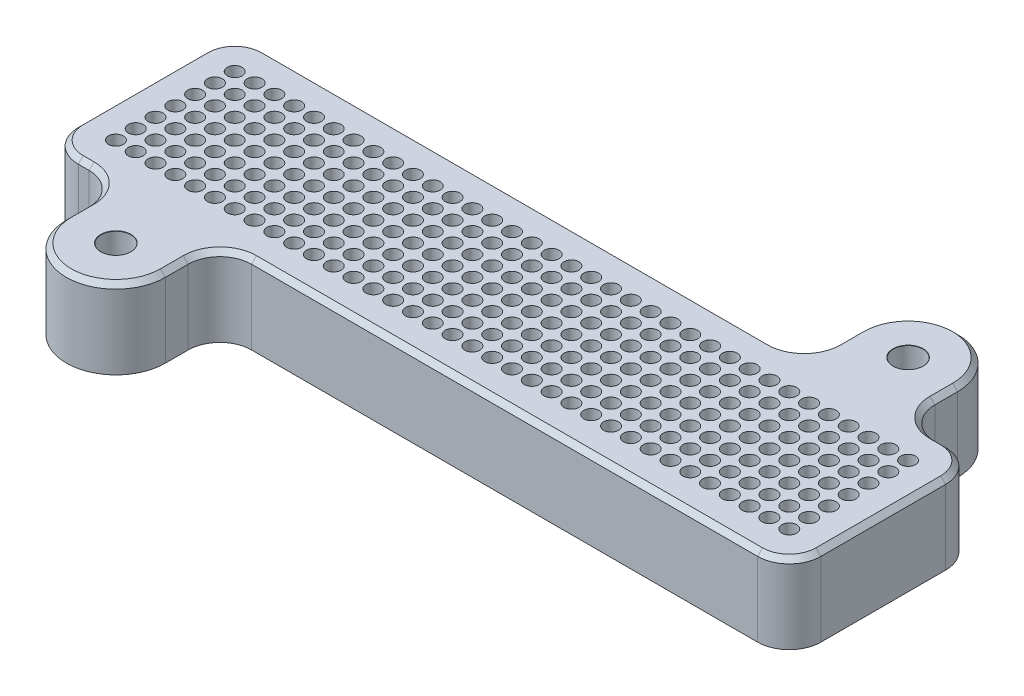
SolidWorks part; units mm, degrees
ref_plane "Front Plane" through (0, 0, 0) normal (0, 0, 1) x (1, 0, 0)
ref_plane "Top Plane" through (0, 0, 0) normal (0, 1, 0) x (1, 0, 0)
ref_plane "Right Plane" through (0, 0, 0) normal (1, 0, 0) x (0, 0, -1)
sketch "Sketch2" plane through (0, 0, 0) normal (0, 1, 0) x (1, 0, 0)
  line L0 (-37.5, 9.5) -> (20, 9.5)
  line L6 (-37.5, -9.5) -> (-37.5, 9.5)
  line L8 (37.5, -9.5) -> (37.5, 9.5)
  line L9 (-37.5, -9.5) -> (37.5, 9.5) construction
  line L10 (-37.5, 9.5) -> (37.5, -9.5) construction
  line L17 (-37.5, -9.5) -> (-30, -9.5)
  line L18 (-30, -15) -> (-30, -9.5)
  line L19 (20, 15) -> (20, 9.5)
  line L20 (-20, -15) -> (-20, -9.5)
  line L22 (30, 15) -> (30, 9.5)
  line L23 (-20, -9.5) -> (37.5, -9.5)
  line L24 (30, 9.5) -> (37.5, 9.5)
  circle A245 centre (0, 0) radius 0.75
  circle A246 centre (2, 0) radius 0.75
  circle A247 centre (4, 0) radius 0.75
  circle A248 centre (6, 0) radius 0.75
  circle A249 centre (8, 0) radius 0.75
  circle A250 centre (10, 0) radius 0.75
  circle A251 centre (12, 0) radius 0.75
  circle A252 centre (14, 0) radius 0.75
  circle A253 centre (16, 0) radius 0.75
  circle A254 centre (18, 0) radius 0.75
  circle A255 centre (20, 0) radius 0.75
  circle A256 centre (22, 0) radius 0.75
  circle A257 centre (24, 0) radius 0.75
  circle A258 centre (26, 0) radius 0.75
  circle A259 centre (28, 0) radius 0.75
  circle A260 centre (30, 0) radius 0.75
  circle A261 centre (32, 0) radius 0.75
  circle A262 centre (34, 0) radius 0.75
  circle A263 centre (2, 2) radius 0.75
  circle A264 centre (4, 2) radius 0.75
  circle A265 centre (6, 2) radius 0.75
  circle A266 centre (8, 2) radius 0.75
  circle A267 centre (10, 2) radius 0.75
  circle A268 centre (12, 2) radius 0.75
  circle A269 centre (14, 2) radius 0.75
  circle A270 centre (16, 2) radius 0.75
  circle A271 centre (18, 2) radius 0.75
  circle A272 centre (20, 2) radius 0.75
  circle A273 centre (22, 2) radius 0.75
  circle A274 centre (24, 2) radius 0.75
  circle A275 centre (26, 2) radius 0.75
  circle A276 centre (28, 2) radius 0.75
  circle A277 centre (30, 2) radius 0.75
  circle A278 centre (32, 2) radius 0.75
  circle A279 centre (34, 2) radius 0.75
  circle A280 centre (2, 4) radius 0.75
  circle A281 centre (4, 4) radius 0.75
  circle A282 centre (6, 4) radius 0.75
  circle A283 centre (8, 4) radius 0.75
  circle A284 centre (10, 4) radius 0.75
  circle A285 centre (12, 4) radius 0.75
  circle A286 centre (14, 4) radius 0.75
  circle A287 centre (16, 4) radius 0.75
  circle A288 centre (18, 4) radius 0.75
  circle A289 centre (20, 4) radius 0.75
  circle A290 centre (22, 4) radius 0.75
  circle A291 centre (24, 4) radius 0.75
  circle A292 centre (26, 4) radius 0.75
  circle A293 centre (28, 4) radius 0.75
  circle A294 centre (30, 4) radius 0.75
  circle A295 centre (32, 4) radius 0.75
  circle A296 centre (34, 4) radius 0.75
  circle A297 centre (2, 6) radius 0.75
  circle A298 centre (4, 6) radius 0.75
  circle A299 centre (6, 6) radius 0.75
  circle A300 centre (8, 6) radius 0.75
  circle A301 centre (10, 6) radius 0.75
  circle A302 centre (12, 6) radius 0.75
  circle A303 centre (14, 6) radius 0.75
  circle A304 centre (16, 6) radius 0.75
  circle A305 centre (18, 6) radius 0.75
  circle A306 centre (20, 6) radius 0.75
  circle A307 centre (22, 6) radius 0.75
  circle A308 centre (24, 6) radius 0.75
  circle A309 centre (26, 6) radius 0.75
  circle A310 centre (28, 6) radius 0.75
  circle A311 centre (30, 6) radius 0.75
  circle A312 centre (32, 6) radius 0.75
  circle A313 centre (34, 6) radius 0.75
  circle A314 centre (0, 2) radius 0.75
  circle A315 centre (0, 4) radius 0.75
  circle A316 centre (0, 6) radius 0.75
  circle A317 centre (-2, 0) radius 0.75
  circle A318 centre (-2, 2) radius 0.75
  circle A319 centre (-2, 4) radius 0.75
  circle A320 centre (-2, 6) radius 0.75
  circle A321 centre (-4, 0) radius 0.75
  circle A322 centre (-4, 2) radius 0.75
  circle A323 centre (-4, 4) radius 0.75
  circle A324 centre (-4, 6) radius 0.75
  circle A325 centre (-6, 0) radius 0.75
  circle A326 centre (-6, 2) radius 0.75
  circle A327 centre (-6, 4) radius 0.75
  circle A328 centre (-6, 6) radius 0.75
  circle A329 centre (-8, 0) radius 0.75
  circle A330 centre (-8, 2) radius 0.75
  circle A331 centre (-8, 4) radius 0.75
  circle A332 centre (-8, 6) radius 0.75
  circle A333 centre (-10, 0) radius 0.75
  circle A334 centre (-10, 2) radius 0.75
  circle A335 centre (-10, 4) radius 0.75
  circle A336 centre (-10, 6) radius 0.75
  circle A337 centre (-12, 0) radius 0.75
  circle A338 centre (-12, 2) radius 0.75
  circle A339 centre (-12, 4) radius 0.75
  circle A340 centre (-12, 6) radius 0.75
  circle A341 centre (-14, 0) radius 0.75
  circle A342 centre (-14, 2) radius 0.75
  circle A343 centre (-14, 4) radius 0.75
  circle A344 centre (-14, 6) radius 0.75
  circle A345 centre (-16, 0) radius 0.75
  circle A346 centre (-16, 2) radius 0.75
  circle A347 centre (-16, 4) radius 0.75
  circle A348 centre (-16, 6) radius 0.75
  circle A349 centre (-18, 0) radius 0.75
  circle A350 centre (-18, 2) radius 0.75
  circle A351 centre (-18, 4) radius 0.75
  circle A352 centre (-18, 6) radius 0.75
  circle A353 centre (-20, 0) radius 0.75
  circle A354 centre (-20, 2) radius 0.75
  circle A355 centre (-20, 4) radius 0.75
  circle A356 centre (-20, 6) radius 0.75
  circle A357 centre (-22, 0) radius 0.75
  circle A358 centre (-22, 2) radius 0.75
  circle A359 centre (-22, 4) radius 0.75
  circle A360 centre (-22, 6) radius 0.75
  circle A361 centre (-24, 0) radius 0.75
  circle A362 centre (-24, 2) radius 0.75
  circle A363 centre (-24, 4) radius 0.75
  circle A364 centre (-24, 6) radius 0.75
  circle A365 centre (-26, 0) radius 0.75
  circle A366 centre (-26, 2) radius 0.75
  circle A367 centre (-26, 4) radius 0.75
  circle A368 centre (-26, 6) radius 0.75
  circle A369 centre (-28, 0) radius 0.75
  circle A370 centre (-28, 2) radius 0.75
  circle A371 centre (-28, 4) radius 0.75
  circle A372 centre (-28, 6) radius 0.75
  circle A373 centre (-30, 0) radius 0.75
  circle A374 centre (-30, 2) radius 0.75
  circle A375 centre (-30, 4) radius 0.75
  circle A376 centre (-30, 6) radius 0.75
  circle A377 centre (-32, 0) radius 0.75
  circle A378 centre (-32, 2) radius 0.75
  circle A379 centre (-32, 4) radius 0.75
  circle A380 centre (-32, 6) radius 0.75
  circle A381 centre (-34, 0) radius 0.75
  circle A382 centre (-34, 2) radius 0.75
  circle A383 centre (-34, 4) radius 0.75
  circle A384 centre (-34, 6) radius 0.75
  circle A385 centre (0, -2) radius 0.75
  circle A386 centre (2, -2) radius 0.75
  circle A387 centre (4, -2) radius 0.75
  circle A388 centre (6, -2) radius 0.75
  circle A389 centre (8, -2) radius 0.75
  circle A390 centre (10, -2) radius 0.75
  circle A391 centre (12, -2) radius 0.75
  circle A392 centre (14, -2) radius 0.75
  circle A393 centre (16, -2) radius 0.75
  circle A394 centre (18, -2) radius 0.75
  circle A395 centre (20, -2) radius 0.75
  circle A396 centre (22, -2) radius 0.75
  circle A397 centre (24, -2) radius 0.75
  circle A398 centre (26, -2) radius 0.75
  circle A399 centre (28, -2) radius 0.75
  circle A400 centre (30, -2) radius 0.75
  circle A401 centre (32, -2) radius 0.75
  circle A402 centre (34, -2) radius 0.75
  circle A403 centre (-2, -2) radius 0.75
  circle A404 centre (-4, -2) radius 0.75
  circle A405 centre (-6, -2) radius 0.75
  circle A406 centre (-8, -2) radius 0.75
  circle A407 centre (-10, -2) radius 0.75
  circle A408 centre (-12, -2) radius 0.75
  circle A409 centre (-14, -2) radius 0.75
  circle A410 centre (-16, -2) radius 0.75
  circle A411 centre (-18, -2) radius 0.75
  circle A412 centre (-20, -2) radius 0.75
  circle A413 centre (-22, -2) radius 0.75
  circle A414 centre (-24, -2) radius 0.75
  circle A415 centre (-26, -2) radius 0.75
  circle A416 centre (-28, -2) radius 0.75
  circle A417 centre (-30, -2) radius 0.75
  circle A418 centre (-32, -2) radius 0.75
  circle A419 centre (-34, -2) radius 0.75
  circle A420 centre (0, -4) radius 0.75
  circle A421 centre (2, -4) radius 0.75
  circle A422 centre (4, -4) radius 0.75
  circle A423 centre (6, -4) radius 0.75
  circle A424 centre (8, -4) radius 0.75
  circle A425 centre (10, -4) radius 0.75
  circle A426 centre (12, -4) radius 0.75
  circle A427 centre (14, -4) radius 0.75
  circle A428 centre (16, -4) radius 0.75
  circle A429 centre (18, -4) radius 0.75
  circle A430 centre (20, -4) radius 0.75
  circle A431 centre (22, -4) radius 0.75
  circle A432 centre (24, -4) radius 0.75
  circle A433 centre (26, -4) radius 0.75
  circle A434 centre (28, -4) radius 0.75
  circle A435 centre (30, -4) radius 0.75
  circle A436 centre (32, -4) radius 0.75
  circle A437 centre (34, -4) radius 0.75
  circle A438 centre (-2, -4) radius 0.75
  circle A439 centre (-4, -4) radius 0.75
  circle A440 centre (-6, -4) radius 0.75
  circle A441 centre (-8, -4) radius 0.75
  circle A442 centre (-10, -4) radius 0.75
  circle A443 centre (-12, -4) radius 0.75
  circle A444 centre (-14, -4) radius 0.75
  circle A445 centre (-16, -4) radius 0.75
  circle A446 centre (-18, -4) radius 0.75
  circle A447 centre (-20, -4) radius 0.75
  circle A448 centre (-22, -4) radius 0.75
  circle A449 centre (-24, -4) radius 0.75
  circle A450 centre (-26, -4) radius 0.75
  circle A451 centre (-28, -4) radius 0.75
  circle A452 centre (-30, -4) radius 0.75
  circle A453 centre (-32, -4) radius 0.75
  circle A454 centre (-34, -4) radius 0.75
  circle A455 centre (0, -6) radius 0.75
  circle A456 centre (2, -6) radius 0.75
  circle A457 centre (4, -6) radius 0.75
  circle A458 centre (6, -6) radius 0.75
  circle A459 centre (8, -6) radius 0.75
  circle A460 centre (10, -6) radius 0.75
  circle A461 centre (12, -6) radius 0.75
  circle A462 centre (14, -6) radius 0.75
  circle A463 centre (16, -6) radius 0.75
  circle A464 centre (18, -6) radius 0.75
  circle A465 centre (20, -6) radius 0.75
  circle A466 centre (22, -6) radius 0.75
  circle A467 centre (24, -6) radius 0.75
  circle A468 centre (26, -6) radius 0.75
  circle A469 centre (28, -6) radius 0.75
  circle A470 centre (30, -6) radius 0.75
  circle A471 centre (32, -6) radius 0.75
  circle A472 centre (34, -6) radius 0.75
  circle A473 centre (-2, -6) radius 0.75
  circle A474 centre (-4, -6) radius 0.75
  circle A475 centre (-6, -6) radius 0.75
  circle A476 centre (-8, -6) radius 0.75
  circle A477 centre (-10, -6) radius 0.75
  circle A478 centre (-12, -6) radius 0.75
  circle A479 centre (-14, -6) radius 0.75
  circle A480 centre (-16, -6) radius 0.75
  circle A481 centre (-18, -6) radius 0.75
  circle A482 centre (-20, -6) radius 0.75
  circle A483 centre (-22, -6) radius 0.75
  circle A484 centre (-24, -6) radius 0.75
  circle A485 centre (-26, -6) radius 0.75
  circle A486 centre (-28, -6) radius 0.75
  circle A487 centre (-30, -6) radius 0.75
  circle A488 centre (-32, -6) radius 0.75
  circle A489 centre (-34, -6) radius 0.75
  arc A494 (-30, -15) -> (-20, -15) centre (-25, -15) ccw
  arc A495 (30, 15) -> (20, 15) centre (25, 15) ccw
  point P0 (0, 0)
  point P10 (-2, 0)
  point P161 (-4, 0)
  point P170 (-6, 0)
  point P179 (-8, 0)
  point P188 (-10, 0)
  point P197 (-12, 0)
  point P206 (-14, 0)
  point P215 (-16, 0)
  point P224 (-18, 0)
  point P233 (-20, 0)
  point P242 (-22, 0)
  point P251 (-24, 0)
  point P260 (-26, 0)
  point P269 (-28, 0)
  point P278 (-30, 0)
  point P287 (-32, 0)
  point P296 (-34, 0)
  point P305 (0, -2)
  point P308 (-2, -2)
  point P345 (-4, -2)
  point P348 (-6, -2)
  point P351 (-8, -2)
  point P354 (-10, -2)
  point P357 (-12, -2)
  point P360 (-14, -2)
  point P363 (-16, -2)
  point P366 (-18, -2)
  point P369 (-20, -2)
  point P372 (-22, -2)
  point P375 (-24, -2)
  point P378 (-26, -2)
  point P381 (-28, -2)
  point P384 (-30, -2)
  point P387 (-32, -2)
  point P390 (-34, -2)
  point P393 (0, -4)
  point P396 (-2, -4)
  point P433 (-4, -4)
  point P436 (-6, -4)
  point P439 (-8, -4)
  point P442 (-10, -4)
  point P445 (-12, -4)
  point P448 (-14, -4)
  point P451 (-16, -4)
  point P454 (-18, -4)
  point P457 (-20, -4)
  point P460 (-22, -4)
  point P463 (-24, -4)
  point P466 (-26, -4)
  point P469 (-28, -4)
  point P472 (-30, -4)
  point P475 (-32, -4)
  point P478 (-34, -4)
  point P481 (0, -6)
  point P484 (-2, -6)
  point P522 (-4, -6)
  point P525 (-6, -6)
  point P528 (-8, -6)
  point P531 (-10, -6)
  point P534 (-12, -6)
  point P537 (-14, -6)
  point P540 (-16, -6)
  point P543 (-18, -6)
  point P546 (-20, -6)
  point P549 (-22, -6)
  point P552 (-24, -6)
  point P555 (-26, -6)
  point P558 (-28, -6)
  point P561 (-30, -6)
  point P564 (-32, -6)
  point P567 (-34, -6)
  dimension "D2" = 19
  dimension "D6" = 18
extrude "Boss-Extrude1" add sketch "Sketch2" along normal blind 8
sketch "Sketch3" plane through (0, 0, 0) normal (0, -1, 0) x (1, 0, 0)
  line L21 (-35, -7) -> (35, -7)
  line L22 (-35, -7) -> (-35, 7)
  line L23 (-35, 7) -> (35, 7)
  line L24 (35, -7) -> (35, 7)
  line L25 (-35, -7) -> (35, 7) construction
  line L26 (-35, 7) -> (35, -7) construction
  line L36 (30, -9.5) -> (37.5, -9.5)
  line L37 (37.5, -9.5) -> (37.5, 9.5)
  line L38 (37.5, 9.5) -> (-20, 9.5)
  line L39 (-20, 9.5) -> (-20, 15)
  line L40 (-30, 15) -> (-30, 9.5)
  line L41 (-30, 9.5) -> (-37.5, 9.5)
  line L42 (-37.5, 9.5) -> (-37.5, -9.5)
  line L43 (-37.5, -9.5) -> (20, -9.5)
  line L44 (20, -9.5) -> (20, -15)
  line L45 (30, -15) -> (30, -9.5)
  line L46 (30, -9.5) -> (37.5, -9.5)
  line L47 (37.5, -9.5) -> (37.5, 9.5)
  line L48 (37.5, 9.5) -> (-20, 9.5)
  line L49 (-20, 9.5) -> (-20, 15)
  line L50 (-30, 15) -> (-30, 9.5)
  line L51 (-30, 9.5) -> (-37.5, 9.5)
  line L52 (-37.5, 9.5) -> (-37.5, -9.5)
  line L53 (-37.5, -9.5) -> (20, -9.5)
  line L54 (20, -9.5) -> (20, -15)
  line L55 (30, -15) -> (30, -9.5)
  arc A6 (-20, 15) -> (-30, 15) centre (-25, 15) ccw
  arc A7 (20, -15) -> (30, -15) centre (25, -15) ccw
  arc A8 (-20, 15) -> (-30, 15) centre (-25, 15) ccw
  arc A9 (20, -15) -> (30, -15) centre (25, -15) ccw
  point P3 (0, 0)
  dimension "D1" = 0
  dimension "D2" = 14
fillet "Fillet7" radius 3.2004 8 edges at (37.5, 4, 9.5) (-20, 4, 9.5) (-30, 4, 9.5) (-37.5, 4, 9.5) (-37.5, 4, -9.5) (20, 4, -9.5) (37.5, 4, -9.5) (30, 4, -9.5)
hole_wizard "Ø3.0mm Dowel Hole1" positions "Sketch4" profile "Sketch5" hole size "Ø3.0" standard "ANSI Metric"
sketch "Sketch4" plane through (0, 8, 0) normal (0, 1, 0) x (1, 0, 0)
  point P0 (-25, -15)
  point P3 (25, 15)
sketch "Sketch5" plane through (-25, 8, 15) normal (1, 0, 0) x (0, 0, 1)
  line L0 (0, 0) -> (0, 10.9013)
  line L1 (0, 10.9013) -> (1.5, 10)
  line L2 (1.5, 10) -> (1.5, 0.025)
  line L3 (1.5, 0.025) -> (1.525, 0)
  line L5 (1.525, 0) -> (0, 0)
  line L6 (-1.5, 0.025) -> (-1.525, 0) construction
  line L10 (0, 10.9013) -> (-1.5, 10) construction
  line L11 (0, -6.35) -> (0, 107.95) construction
  dimension "Hole Dia." = 3
  dimension "Hole Depth" = 10
  dimension "Near C'Sink Dia." = 3.05
  dimension "Near C'Sink Angle" = 90
  dimension "Drill Angle" = 118
chamfer "Chamfer1" distance 0.5 angle 45 20 edges at (-19.0626, 8, 10.4374) (-20, 8, 13.8502) (-25, 8, 20) (-30, 8, 13.8502) (-30.9374, 8, 10.4374) (-33.75, 8, 9.5) (-36.5626, 8, 8.5626) (-37.5, 8, 0) (-36.5626, 8, -8.5626) (-8.75, 8, -9.5) (19.0626, 8, -10.4374) (20, 8, -13.8502) (25, 8, -20) (30, 8, -13.8502) (30.9374, 8, -10.4374) (33.75, 8, -9.5) (36.5626, 8, -8.5626) (37.5, 8, 0) (36.5626, 8, 8.5626) (8.75, 8, 9.5)
sketch3d "3DSketch1"
  point P0 (0, 10.54, 0)
